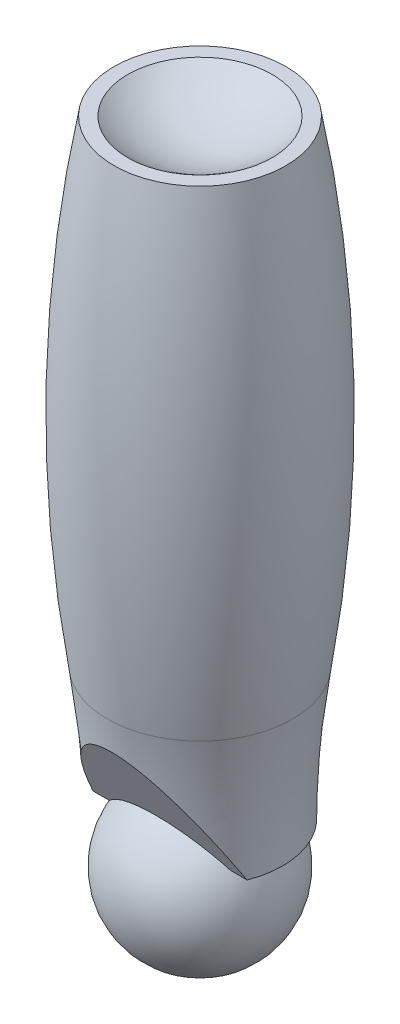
SolidWorks part; units mm, degrees
ref_plane "Přední" through (0, 0, 0) normal (0, 0, 1) x (1, 0, 0)
ref_plane "Horní" through (0, 0, 0) normal (0, 1, 0) x (1, 0, 0)
ref_plane "Pravá" through (0, 0, 0) normal (1, 0, 0) x (0, 0, -1)
sketch "Skica1" plane through (0, 0, 0) normal (0, 0, 1) x (1, 0, 0)
  line L0 (0, 0) -> (0, 264.5)
  line L1 (0, 264.5) -> (37.375, 264.5)
  line L2 (35.9375, 0) -> (0, 0)
  line L3 (0, 0) -> (0, -16.447) construction
  line L4 (35.9375, 0) -> (35.9375, -72.7987) construction
  arc A0 (37.375, 264.5) -> (40.2802, 57.5) centre (-583.5112, 152.2655) cw
  arc A1 (40.2802, 57.5) -> (35.9375, 0) centre (418.7726, 0) ccw
  dimension "D4" = 94.875
  dimension "D1" = 74.75
  dimension "D2" = 264.5
  dimension "D3" = 71.875
  dimension "D5" = 57.5
revolve "Otočit kolem osy1" add sketch "Skica1" angle 360 about L0
sketch "Skica2" plane through (0, 0, 0) normal (0, 0, 1) x (1, 0, 0)
  line L0 (0, 253.5) -> (0, 303.815)
  line L1 (0, 303.815) -> (-50.315, 303.815)
  line L2 (0, 253.5) -> (58.1664, 253.5) construction
  line L3 (0, 303.815) -> (0, 288.1436) construction
  line L4 (-50.315, 303.815) -> (-50.315, 294.4827) construction
  line L5 (37.375, 264.5) -> (-37.375, 264.5) construction
  arc A0 (0, 253.5) -> (-50.315, 303.815) centre (0, 303.815) cw
  dimension "D1" = 100.63
  dimension "D2" = 11
revolve "Odebrat otočením1" cut sketch "Skica2" angle 360 about L0
sketch "Skica3" plane through (0, 0, 0) normal (0, 0, 1) x (1, 0, 0)
  line L0 (0, -18) -> (0, 16.5)
  line L1 (-35.9375, 0) -> (35.9375, 0) construction
  line L2 (0, 16.5) -> (21.2332, 16.5) construction
  line L3 (0, -18) -> (0, -52.5)
  arc A0 (0, 16.5) -> (0, -52.5) centre (0, -18) ccw
  dimension "D1" = 34.5
  dimension "D2" = 18
sketch "Skica4" plane through (0, 0, 0) normal (1, 0, 0) x (0, 0, -1)
  line L0 (-13, 0) -> (-38.4922, 44.1539)
  line L1 (-35.9375, 0) -> (35.9375, 0) construction
  arc A0 (-35.9375, 0) -> (-40.2802, 57.5) centre (-418.7726, 0) ccw construction
  dimension "D1" = 13
  dimension "D2" = 60
sketch "Skica6" plane through (0, 0, 0) normal (0, -1, 0) x (1, 0, 0)
  line L0 (0, 13) -> (33.5038, 13)
  circle A1 centre (0, 0) radius 35.9375 construction
ref_plane "Rovina2" through (0, -5.6292, 9.75) normal (0, 0.5, -0.866) x (-1, 0, 0)
other "Odebrat povrchem2"
revolve "Otočit kolem osy2" add sketch "Skica3" angle 360 about L0
